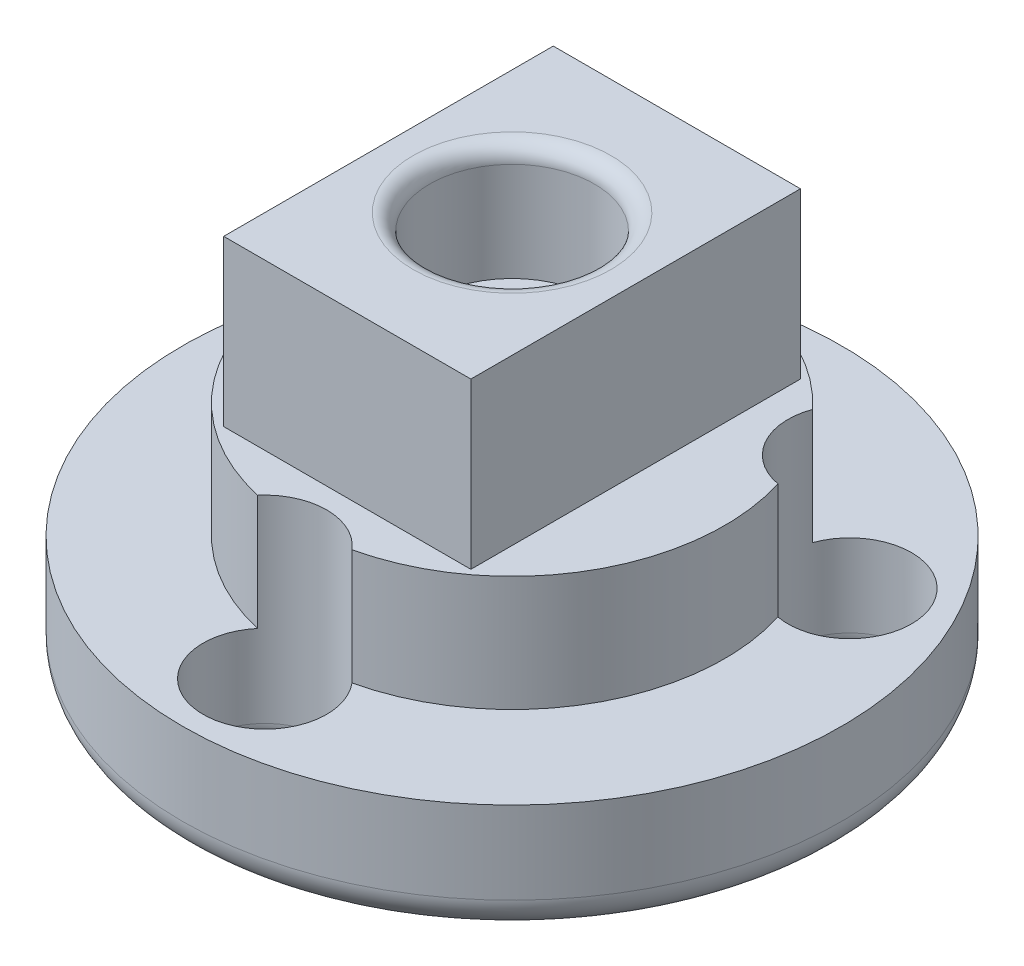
SolidWorks part; units mm, degrees
ref_plane "Ebene vorne" through (0, 0, 0) normal (0, 0, 1) x (1, 0, 0)
ref_plane "Ebene oben" through (0, 0, 0) normal (0, 1, 0) x (1, 0, 0)
ref_plane "Ebene rechts" through (0, 0, 0) normal (1, 0, 0) x (0, 0, -1)
sketch "Skizze1" plane through (0, 0, 0) normal (0, 1, 0) x (1, 0, 0)
  circle A0 centre (0, 0) radius 20
  dimension "D1" = 40
extrude "Aufsatz-Linear austragen1" add sketch "Skizze1" along normal blind 7
sketch "Skizze3" plane through (0, 7, 0) normal (0, 1, 0) x (1, 0, 0)
  circle A0 centre (0, 0) radius 12.9
  dimension "D1" = 25.8
extrude "Aufsatz-Linear austragen2" add sketch "Skizze3" along normal blind 7
sketch "Skizze4" plane through (0, 0, 0) normal (0, -1, 0) x (1, 0, 0)
  circle A0 centre (0, 0) radius 15
  dimension "D1" = 30
sketch "Skizze5" plane through (0, 0, 0) normal (0, -1, 0) x (-1, 0, 0)
  circle A0 centre (0, -15) radius 3.75
  circle A1 centre (0, 0) radius 15 construction
  circle A2 centre (-12.9904, 7.5) radius 3.75
  circle A3 centre (12.9904, 7.5) radius 3.75
  point P11 (0, 0)
  dimension "D1" = 7.5
  dimension "D2" = 3
extrude "Schnitt-Linear austragen1" cut sketch "Skizze5" against normal through all contours A0 | A2 | A3
sketch "Skizze7" plane through (0, 14, 0) normal (0, 1, 0) x (1, 0, 0)
  line L1 (-7.5, 10) -> (7.5, 10)
  line L2 (-7.5, 10) -> (-7.5, -10)
  line L3 (-7.5, -10) -> (7.5, -10)
  line L4 (7.5, 10) -> (7.5, -10)
  dimension "D1" = 15
  dimension "D2" = 7.5
  dimension "D3" = 20
  dimension "D4" = 10
extrude "Aufsatz-Linear austragen3" add sketch "Skizze7" along normal blind 10
sketch "Skizze8" plane through (0, 24, 0) normal (0, 1, 0) x (1, 0, 0)
  circle A0 centre (0, 0) radius 5
extrude "Schnitt-Linear austragen2" cut sketch "Skizze8" against normal blind 7 contours A0
fillet "Verrundung2" radius 1 1 edges at (0, 24, 5)
fillet "Verrundung3" radius 2 4 edges at (0, 0, 11.25) (-12.9904, 0, -11.25) (12.9904, 0, -11.25) (0, 0, 20)
